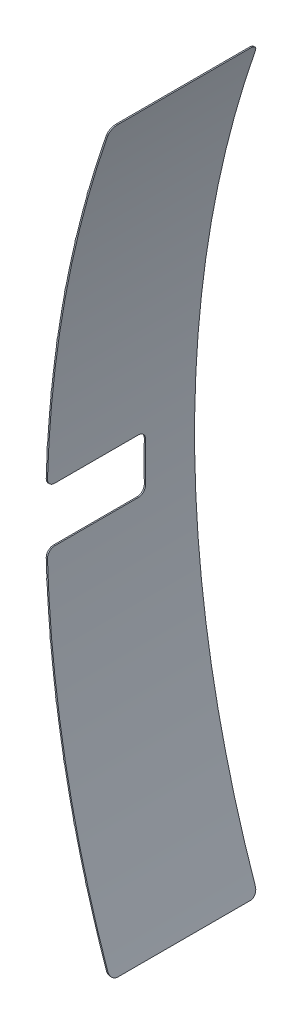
SolidWorks part; units mm, degrees
ref_plane "前视基准面" through (0, 0, 0) normal (0, 0, 1) x (1, 0, 0)
ref_plane "上视基准面" through (0, 0, 0) normal (0, 1, 0) x (1, 0, 0)
ref_plane "右视基准面" through (0, 0, 0) normal (1, 0, 0) x (0, 0, -1)
sketch "草图1" plane through (0, 0, 0) normal (0, 0, 1) x (1, 0, 0)
  line L0 (-42.4794, 15) -> (-42.4264, 15)
  line L1 (-42.4794, -15) -> (-42.4264, -15)
  line L2 (-1000, 0) -> (49000, 0) construction
  arc A0 (-42.4794, 15) -> (-42.4794, -15) centre (0, 0) ccw
  arc A1 (-42.4264, 15) -> (-42.4264, -15) centre (0, 0) ccw
  dimension "D1" = 90.1
  dimension "D2" = 90
  dimension "D3" = 30
extrude "凸台-拉伸1" add sketch "草图1" along normal blind 6
ref_plane "基准面1" through (-50, 0, 0) normal (1, 0, 0) x (0, 0, -1)
sketch "草图4" plane through (0, 0, 0) normal (1, 0, 0) x (0, 0, -1)
  line L0 (-6, -1.1) -> (-2, -1.1)
  line L1 (-6, 15) -> (-6, -15) construction
  line L2 (-2, -1.1) -> (-2, 1.1)
  line L3 (-2, 1.1) -> (-6, 1.1)
  line L4 (-6, 1.1) -> (-6, -1.1)
  line L5 (-1000, 0) -> (49000, 0) construction
  dimension "D1" = 4
  dimension "D2" = 2.2
extrude "切除-拉伸1" cut sketch "草图4" against normal through all
fillet "圆角1" radius 0.3 8 edges at (-42.4529, -15, 6) (-42.4529, -15, 0) (-42.4529, 15, 6) (-42.4529, 15, 0) (-45.0116, -1.1, 2) (-45.0116, 1.1, 2) (-45.0116, 1.1, 6) (-45.0116, -1.1, 6)
sketch "草图5" plane through (-50, 0, 0) normal (1, 0, 0) x (0, 0, -1)
  line L0 (0, -2.8572) -> (0, 3.1428)
  line L1 (0, 3.1428) -> (-2, 0.1428)
  line L2 (-2, 0.1428) -> (0, -2.8572)
  line L3 (-1002, 0.1428) -> (48998, 0.1428) construction
  line L4 (0, -14.7) -> (0, 14.7) construction
  line L5 (-2, 0.8) -> (-2, -0.8) construction
  line L6 (-6, -1.4) -> (-6, -14.7) construction
  line L7 (-6, -2.3) -> (-2, -2.3)
  line L8 (-6, -2.3) -> (-6, -2.1)
  line L9 (-6, -2.1) -> (-2, -2.1)
  line L10 (-2, -2.3) -> (-2, -2.1)
  line L11 (-6, -4.3) -> (-2, -4.3)
  line L12 (-6, -4.3) -> (-6, -4.1)
  line L13 (-6, -4.1) -> (-2, -4.1)
  line L14 (-2, -4.3) -> (-2, -4.1)
  line L15 (-6, -6.3) -> (-2, -6.3)
  line L16 (-6, -6.3) -> (-6, -6.1)
  line L17 (-6, -6.1) -> (-2, -6.1)
  line L18 (-2, -6.3) -> (-2, -6.1)
  line L19 (-6, -8.3) -> (-2, -8.3)
  line L20 (-6, -8.3) -> (-6, -8.1)
  line L21 (-6, -8.1) -> (-2, -8.1)
  line L22 (-2, -8.3) -> (-2, -8.1)
  line L23 (-6, -10.3) -> (-2, -10.3)
  line L24 (-6, -10.3) -> (-6, -10.1)
  line L25 (-6, -10.1) -> (-2, -10.1)
  line L26 (-2, -10.3) -> (-2, -10.1)
  line L27 (-6, -12.3) -> (-2, -12.3)
  line L28 (-6, -12.3) -> (-6, -12.1)
  line L29 (-6, -12.1) -> (-2, -12.1)
  line L30 (-2, -12.3) -> (-2, -12.1)
  line L31 (-5.7, -1.1) -> (-2.3, -1.1) construction
  line L32 (-2, 12.5855) -> (-2, 12.3855)
  line L33 (-6, 12.3855) -> (-2, 12.3855)
  line L34 (-6, 12.5855) -> (-6, 12.3855)
  line L35 (-6, 12.5855) -> (-2, 12.5855)
  line L36 (-2, 10.5855) -> (-2, 10.3855)
  line L37 (-6, 10.3855) -> (-2, 10.3855)
  line L38 (-6, 10.5855) -> (-6, 10.3855)
  line L39 (-6, 10.5855) -> (-2, 10.5855)
  line L40 (-2, 8.5855) -> (-2, 8.3855)
  line L41 (-6, 8.3855) -> (-2, 8.3855)
  line L42 (-6, 8.5855) -> (-6, 8.3855)
  line L43 (-6, 8.5855) -> (-2, 8.5855)
  line L44 (-2, 6.5855) -> (-2, 6.3855)
  line L45 (-6, 6.3855) -> (-2, 6.3855)
  line L46 (-6, 6.5855) -> (-6, 6.3855)
  line L47 (-6, 6.5855) -> (-2, 6.5855)
  line L48 (-2, 4.5855) -> (-2, 4.3855)
  line L49 (-6, 4.3855) -> (-2, 4.3855)
  line L50 (-6, 4.5855) -> (-6, 4.3855)
  line L51 (-6, 4.5855) -> (-2, 4.5855)
  line L52 (-2, 2.5855) -> (-2, 2.3855)
  line L53 (-6, 2.3855) -> (-2, 2.3855)
  line L54 (-6, 2.5855) -> (-6, 2.3855)
  line L55 (-6, 2.5855) -> (-2, 2.5855)
  dimension "D1" = 6
  dimension "D2" = 0.2
  dimension "D3" = 4
  dimension "D5" = 1
  dimension "D4" = 6
wrap "包覆1" sketch "草图5" wrap type emboss source sketch "草图5" thickness 0.01 parameters "D1"=0.01
